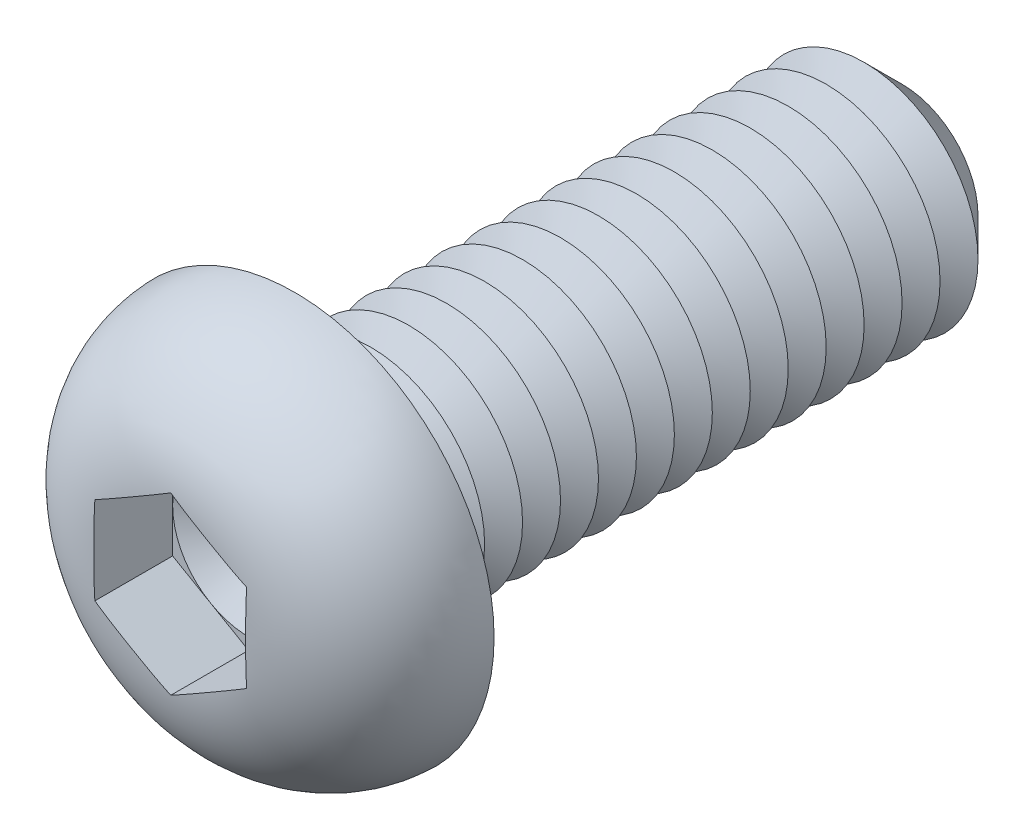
SolidWorks part; units mm, degrees
ref_plane "Front Plane" through (0, 0, 0) normal (0, 0, 1) x (1, 0, 0)
ref_plane "Top Plane" through (0, 0, 0) normal (0, 1, 0) x (1, 0, 0)
ref_plane "Right Plane" through (0, 0, 0) normal (1, 0, 0) x (0, 0, -1)
sketch "Sketch1" plane through (0, 0, 0) normal (1, 0, 0) x (0, 0, -1)
  line L0 (-47.9342, 0) -> (60.3146, 0) construction
sketch "Sketch2" plane through (0, 0, 0) normal (1, 0, 0) x (0, 0, -1)
  line L0 (0, 0) -> (-3.3, 0)
  line L1 (-47.9342, 0) -> (60.3146, 0) construction
  line L2 (-3.3, 0) -> (-3.3, 1.8515)
  line L3 (0, 5.25) -> (0, 0)
  arc A0 (-3.3, 1.8515) -> (0, 5.25) centre (0.1, 1.8515) cw
  dimension "D1" = 3.4
  dimension "D2" = 3.3
  dimension "D3" = 5.25
revolve "Revolve1" add sketch "Sketch2" angle 360 about L0
sketch "Sketch3" plane through (0, 0, 3.3) normal (0, 0, 1) x (1, 0, 0)
  line L1 (0, 2.3094) -> (-2, 1.1547)
  line L2 (-2, 1.1547) -> (-2, -1.1547)
  line L3 (-2, -1.1547) -> (0, -2.3094)
  line L4 (0, -2.3094) -> (2, -1.1547)
  line L5 (2, -1.1547) -> (2, 1.1547)
  line L6 (2, 1.1547) -> (0, 2.3094)
  circle A0 centre (0, 0) radius 2 construction
  dimension "D1" = 4
extrude "Cut-Extrude1" cut sketch "Sketch3" against normal blind 2.08
sketch "Sketch4" plane through (0, 0, 0) normal (0, 0, -1) x (-1, 0, 0)
  circle A0 centre (0, 0) radius 3
  dimension "D1" = 6
extrude "Boss-Extrude1" add sketch "Sketch4" along normal blind 16
chamfer "Chamfer1" distance 1 angle 45 1 edges at (-3, 0, -16)
sketch "Sketch5" plane through (0, 0, 0) normal (1, 0, 0) x (0, 0, -1)
  line L0 (1, 3) -> (2, 3)
  line L1 (15, 3) -> (0, 3) construction
  line L2 (2, 3) -> (1.5, 2.134)
  line L3 (1.5, 2.134) -> (1, 3)
  line L4 (0, -5.25) -> (0, 5.25) construction
  line L5 (15, 3) -> (0, 3) construction
  dimension "D1" = 1
  dimension "D2" = 1
revolve "Cut-Revolve1" cut sketch "Sketch5" angle 360 about L0
pattern_linear "LPattern1" count 14 spacing 1 along (0, 0, -1) of "Cut-Revolve1"
fillet "Fillet2" radius 0.5 1 edges at (-3, 0, 0)
sketch "Sketch6" plane through (0, 0, 1.22) normal (0, 0, 1) x (1, 0, 0)
  line L0 (0, -2.3094) -> (2, -1.1547) construction
  circle A0 centre (0, 0) radius 2
extrude "Cut-Extrude2" cut sketch "Sketch6" against normal through all draft 60
